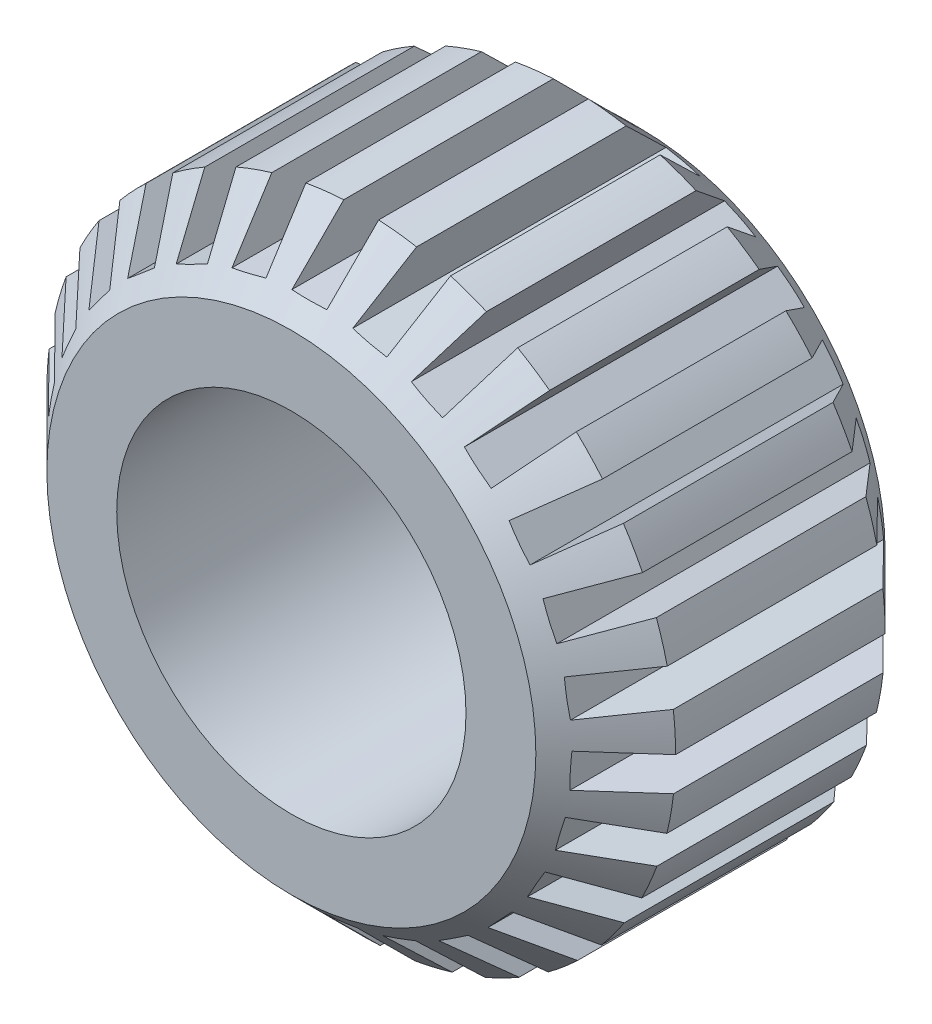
SolidWorks part; units mm, degrees
ref_plane "Front Plane" through (0, 0, 0) normal (0, 0, 1) x (1, 0, 0)
ref_plane "Top Plane" through (0, 0, 0) normal (0, 1, 0) x (1, 0, 0)
ref_plane "Right Plane" through (0, 0, 0) normal (1, 0, 0) x (0, 0, -1)
sketch "Croquis1" plane through (0, 0, 0) normal (0, 0, 1) x (1, 0, 0)
  circle A0 centre (0, 0) radius 5
  circle A1 centre (0, 0) radius 9
  circle A2 centre (0, 0) radius 1
  dimension "D1" = 10
  dimension "D2" = 4
  dimension "D3" = 4
extrude "Saliente-Extruir2" add sketch "Croquis1" along normal blind 10 contours A1 A0
chamfer "Chaflán1" distance 2 angle 45 2 edges at (9, 0, 10) (9, 0, 0)
sketch "Croquis2" plane through (0, 0, 0) normal (0, 0, 1) x (1, 0, 0)
  line L0 (0, 7.5) -> (0, 9) construction
  line L1 (0.5, 7.5) -> (0.5, 8.9861)
  line L2 (-0.5, 7.5) -> (-0.5, 8.9861)
  line L3 (-0.5, 7.5) -> (0.5, 7.5)
  line L4 (0.5, 0) -> (0.5, 9) construction
  line L5 (0, 0) -> (0, 9) construction
  line L6 (-0.5, 0) -> (-0.5, 9) construction
  circle A0 centre (0, 0) radius 9 construction
  arc A1 (0.5, 8.9861) -> (-0.5, 8.9861) centre (0, 0) ccw
  dimension "D3" = 7.5
  dimension "D1" = 0.5
  dimension "D2" = 0.5
extrude "Cortar-Extruir1" cut sketch "Croquis2" along normal through all
pattern_circular "MatrizC1" count 27 over 360 about axis through (0, 0, 0) along (0, 0, 1) of "Cortar-Extruir1"
